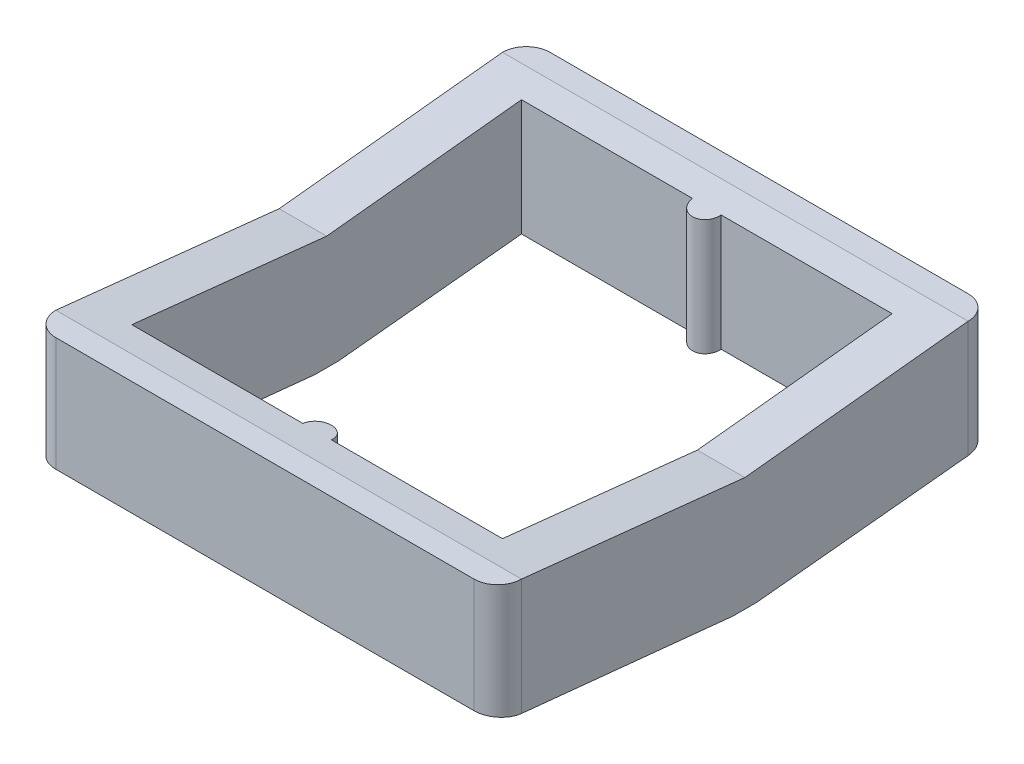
SolidWorks part; units mm, degrees
ref_plane "正面" through (0, 0, 0) normal (0, 0, 1) x (1, 0, 0)
ref_plane "平面" through (0, 0, 0) normal (0, 1, 0) x (1, 0, 0)
ref_plane "右側面" through (0, 0, 0) normal (1, 0, 0) x (0, 0, -1)
sketch "ｽｹｯﾁ1" plane through (0, 0, 0) normal (-1, 0, 0) x (0, 1, 0)
  line L1 (0, -0.25) -> (0, 0.25)
  line L34 (0, -0.25) -> (0.5, -5.2)
  line L35 (2.4, 0) -> (2.9, -4.7)
  line L36 (2.4, 0) -> (2.9, 4.7)
  line L37 (0, 0.25) -> (0.5, 5.2)
  line L38 (2.9, 5.2) -> (2.9, 4.7)
  line L39 (2.9, 5.2) -> (0.5, 5.2)
  line L41 (2.9, -5.2) -> (2.9, -4.7)
  line L42 (2.9, -5.2) -> (0.5, -5.2)
  dimension "D1" = 0.25
  dimension "D2" = 0.5
  dimension "D3" = 10.4
  dimension "D4" = 0.5
  dimension "D5" = 0.5
  dimension "D6" = 5.2
  dimension "D7" = 2.4
  dimension "D8" = 2.4
  dimension "D9" = 2.9
  dimension "D10" = 0.5
  dimension "D11" = 0.5
extrude "押し出し1" add sketch "ｽｹｯﾁ1" along normal blind 9.8
sketch "ｽｹｯﾁ2" plane through (0, 2.9, 0) normal (0, 1, 0) x (1, 0, 0)
  line L0 (-9.8, 5.2) -> (0, 5.2) construction
  line L1 (-9.8, 0) -> (-9.8, 4.7) construction
  line L3 (-5.2, 4.1) -> (-8.8, 4.1)
  line L4 (-5.2, -4.1) -> (-8.8, -4.1)
  line L11 (-8.8, -4.1) -> (-8.8, 4.1)
  line L12 (-1, -4.1) -> (-4.6, -4.1)
  line L13 (-1, 4.1) -> (-4.6, 4.1)
  line L14 (-1, -4.1) -> (-1, 4.1)
  arc A0 (-5.2, 4.1) -> (-4.6, 4.1) centre (-4.9, 4.1) ccw
  arc A1 (-4.6, -4.1) -> (-5.2, -4.1) centre (-4.9, -4.1) ccw
  dimension "D5" = 7.6
  dimension "D1" = 1.1
  dimension "D2" = 8.2
  dimension "D3" = 7.8
  dimension "D4" = 1
extrude "押し出し2" cut sketch "ｽｹｯﾁ2" against normal through all
fillet "ﾌｨﾚｯﾄ1" radius 0.5 4 edges at (-9.8, 1.7, -5.2) (-9.8, 1.7, 5.2) (0, 1.7, 5.2) (0, 1.7, -5.2)
